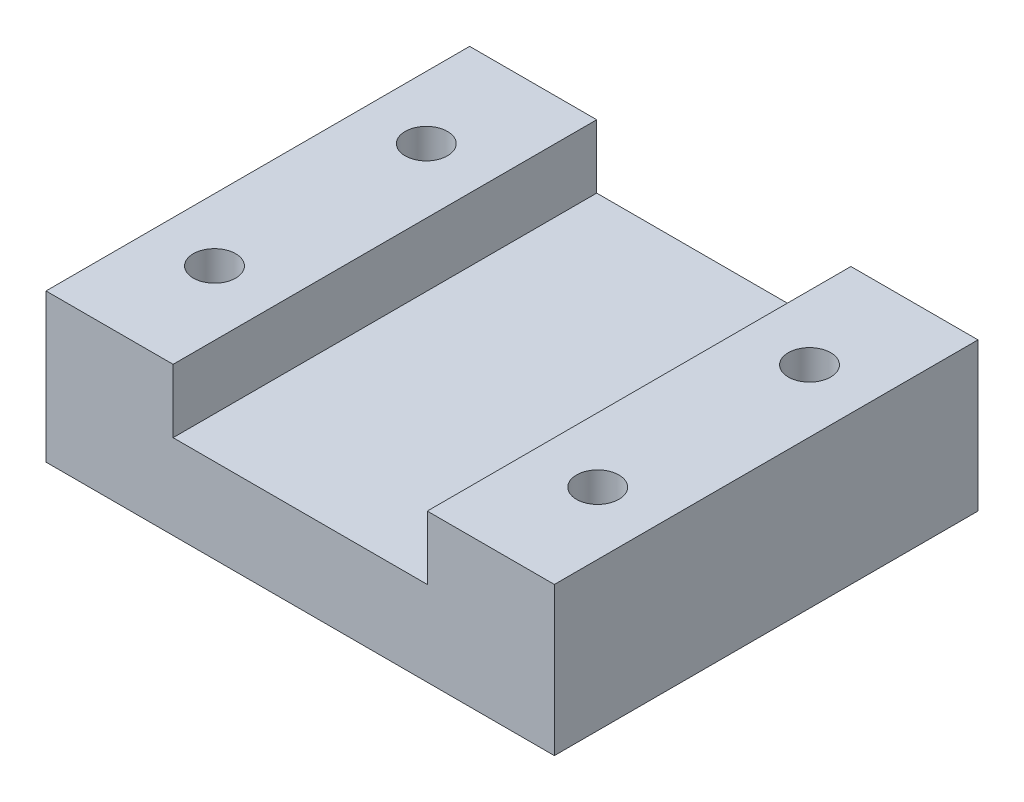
SolidWorks part; units mm, degrees
ref_plane "Front Plane" through (0, 0, 0) normal (0, 0, 1) x (1, 0, 0)
ref_plane "Top Plane" through (0, 0, 0) normal (0, 1, 0) x (1, 0, 0)
ref_plane "Right Plane" through (0, 0, 0) normal (1, 0, 0) x (0, 0, -1)
sketch "Base Sketch" plane through (0, 0, 0) normal (0, 0, 1) x (1, 0, 0)
  line L0 (-76.2, 0) -> (76.2, 0)
  line L1 (76.2, 0) -> (76.2, 44.45)
  line L2 (76.2, 44.45) -> (38.1, 44.45)
  line L3 (38.1, 44.45) -> (38.1, 25.4)
  line L4 (38.1, 25.4) -> (-38.1, 25.4)
  line L5 (-38.1, 25.4) -> (-38.1, 44.45)
  line L6 (-38.1, 44.45) -> (-76.2, 44.45)
  line L7 (-76.2, 44.45) -> (-76.2, 0)
  dimension "D1" = 38.1
  dimension "D2" = 152.4
  dimension "D3" = 25.4
  dimension "D4" = 19.05
extrude "Extrude1" add sketch "Base Sketch" along normal mid plane 127
sketch "Hole Sketch" plane through (0, 44.45, 0) normal (0, 1, 0) x (-1, 0, 0)
  circle A0 centre (57.4395, 31.75) radius 6.35
  circle A1 centre (57.4395, -31.75) radius 6.35
  dimension "D1" = 63.5
  dimension "D2" = 31.75
  dimension "D3" = 12.7
extrude "Cut-Extrude2" cut sketch "Hole Sketch" against normal through all
mirror "Mirror1" about plane through (0, 0, 0) normal (1, 0, 0) of "Cut-Extrude2"
sketch "Clamp1" plane through (0, 44.45, 0) normal (0, 1, 0) x (-1, 0, 0)
  line L1 (-8.4667, -50.2356) -> (15.8044, -50.2356)
  line L2 (-8.4667, -50.2356) -> (-8.4667, -81.8444)
  line L3 (-8.4667, -81.8444) -> (15.8044, -81.8444)
  line L4 (15.8044, -50.2356) -> (15.8044, -81.8444)
sketch "Clamp2" plane through (0, 44.45, 0) normal (0, 1, 0) x (-1, 0, 0)
  line L1 (-9.6896, 81.2643) -> (18.0873, 81.2643)
  line L2 (-9.6896, 81.2643) -> (-9.6896, 48.3196)
  line L3 (-9.6896, 48.3196) -> (18.0873, 48.3196)
  line L4 (18.0873, 81.2643) -> (18.0873, 48.3196)
